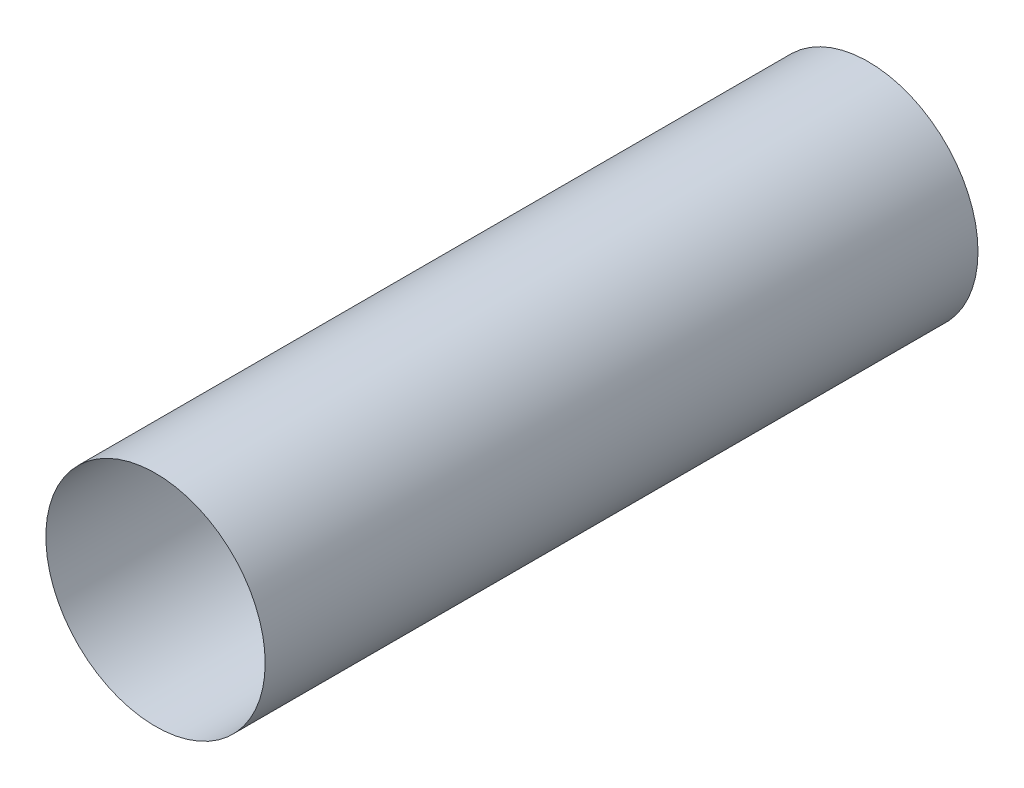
SolidWorks part; units mm, degrees
ref_plane "Front Plane" through (0, 0, 0) normal (0, 0, 1) x (1, 0, 0)
ref_plane "Top Plane" through (0, 0, 0) normal (0, 1, 0) x (1, 0, 0)
ref_plane "Right Plane" through (0, 0, 0) normal (1, 0, 0) x (0, 0, -1)
sketch "Sketch1" plane through (0, 0, 0) normal (0, 0, 1) x (1, 0, 0)
  circle A0 centre (-88.6962, 56.7665) radius 200
surface "Surface-Extrude1" sketch "Sketch1" parameters "D1"=1300
